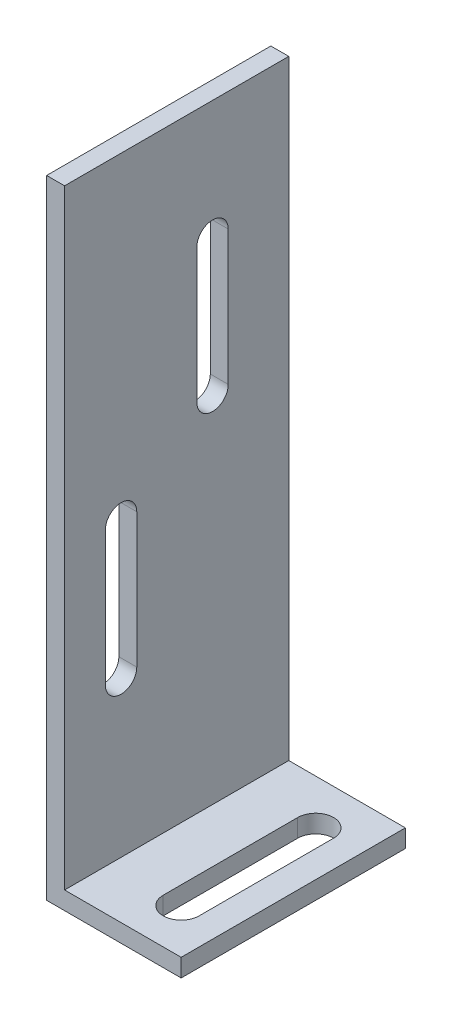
SolidWorks part; units mm, degrees
ref_plane "Plan de face" through (0, 0, 0) normal (0, 0, 1) x (1, 0, 0)
ref_plane "Plan de dessus" through (0, 0, 0) normal (0, 1, 0) x (1, 0, 0)
ref_plane "Plan de droite" through (0, 0, 0) normal (1, 0, 0) x (0, 0, -1)
sketch "Esquisse1" plane through (0, 0, 0) normal (0, 0, 1) x (1, 0, 0)
  line L0 (0, 70) -> (0, 0)
  line L1 (0, 0) -> (15, 0)
  line L2 (15, 0) -> (15, 2)
  line L3 (15, 2) -> (2, 2)
  line L4 (2, 2) -> (2, 70)
  line L5 (2, 70) -> (0, 70)
  dimension "D1" = 70
  dimension "D2" = 2
  dimension "D3" = 2
  dimension "D4" = 15
extrude "Boss.-Extru.1" add sketch "Esquisse1" against normal blind 25
sketch "Esquisse2" plane through (0, 2, 0) normal (0, 1, 0) x (1, 0, 0)
  line L0 (-5.6492, 10) -> (62.3476, 10) construction
  line L2 (0, 25) -> (0, 0) construction
  line L3 (8, 20) -> (8, 5)
  line L5 (12, 20) -> (12, 5)
  arc A0 (12, 20) -> (8, 20) centre (10, 20) ccw
  arc A1 (8, 5) -> (12, 5) centre (10, 5) ccw
  dimension "D2" = 4
  dimension "D1" = 10
  dimension "D4" = 15
  dimension "D5" = 5
  dimension "D9" = 10
extrude "Enlèv. mat.-Extru.1" cut sketch "Esquisse2" against normal through all
sketch "Esquisse3" plane through (0, 0, 0) normal (-1, 0, 0) x (0, 0, 1)
  line L0 (-12.5, 72.0009) -> (-12.5, -4.1284) construction
  line L1 (-25.2629, 27) -> (4.8928, 27) construction
  line L2 (-24.313, 49.2) -> (4.4552, 49.2) construction
  line L3 (-16.5, 59.4088) -> (-16.5, 38.0624) construction
  line L4 (-6.3, 37.3234) -> (-6.3, 13.5605) construction
  line L5 (-25, 0) -> (0, 0) construction
  line L6 (-25, 70) -> (-25, 0) construction
  line L8 (-18.25, 56.7) -> (-18.25, 41.7)
  line L10 (-14.75, 56.7) -> (-14.75, 41.7)
  line L11 (-8.05, 34.5) -> (-8.05, 19.5)
  line L13 (-4.55, 34.5) -> (-4.55, 19.5)
  arc A0 (-4.55, 34.5) -> (-8.05, 34.5) centre (-6.3, 34.5) ccw
  arc A1 (-18.25, 56.7) -> (-14.75, 56.7) centre (-16.5, 56.7) cw
  arc A2 (-14.75, 41.7) -> (-18.25, 41.7) centre (-16.5, 41.7) cw
  arc A3 (-8.05, 19.5) -> (-4.55, 19.5) centre (-6.3, 19.5) ccw
  dimension "D1" = 6.2
  dimension "D2" = 3.5
  dimension "D5" = 4
  dimension "D9" = 1.75
  dimension "D10" = 15
  dimension "D3" = 27
  dimension "D4" = 12.5
  dimension "D6" = 3.5
  dimension "D7" = 22.2
  dimension "D8" = 1.75
  dimension "D11" = 15
  dimension "D12" = 7.5
  dimension "D13" = 7.5
extrude "Enlèv. mat.-Extru.2" cut sketch "Esquisse3" against normal through all
